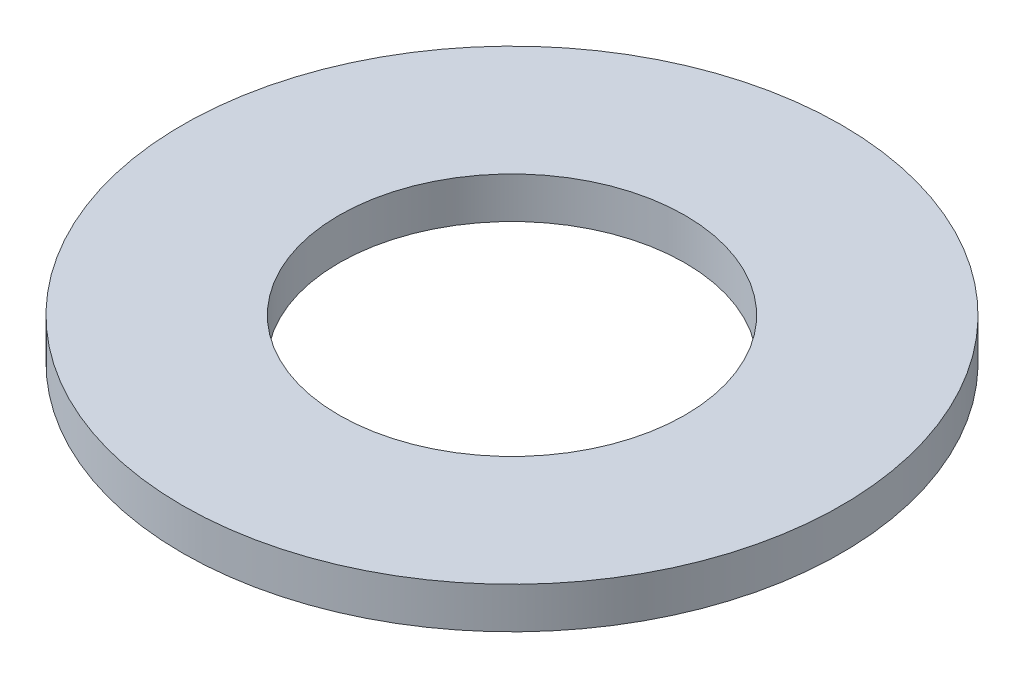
SolidWorks part; units mm, degrees
ref_plane "Plan de face" through (0, 0, 0) normal (0, 0, 1) x (1, 0, 0)
ref_plane "Plan de dessus" through (0, 0, 0) normal (0, 1, 0) x (1, 0, 0)
ref_plane "Plan de droite" through (0, 0, 0) normal (1, 0, 0) x (0, 0, -1)
sketch "Esquisse1" plane through (0, 0, 0) normal (0, 1, 0) x (1, 0, 0)
  circle A0 centre (0, 0) radius 40
  circle A1 centre (0, 0) radius 21
  dimension "D1" = 42
  dimension "D2" = 80
extrude "Extrusion1" add sketch "Esquisse1" along normal blind 5
